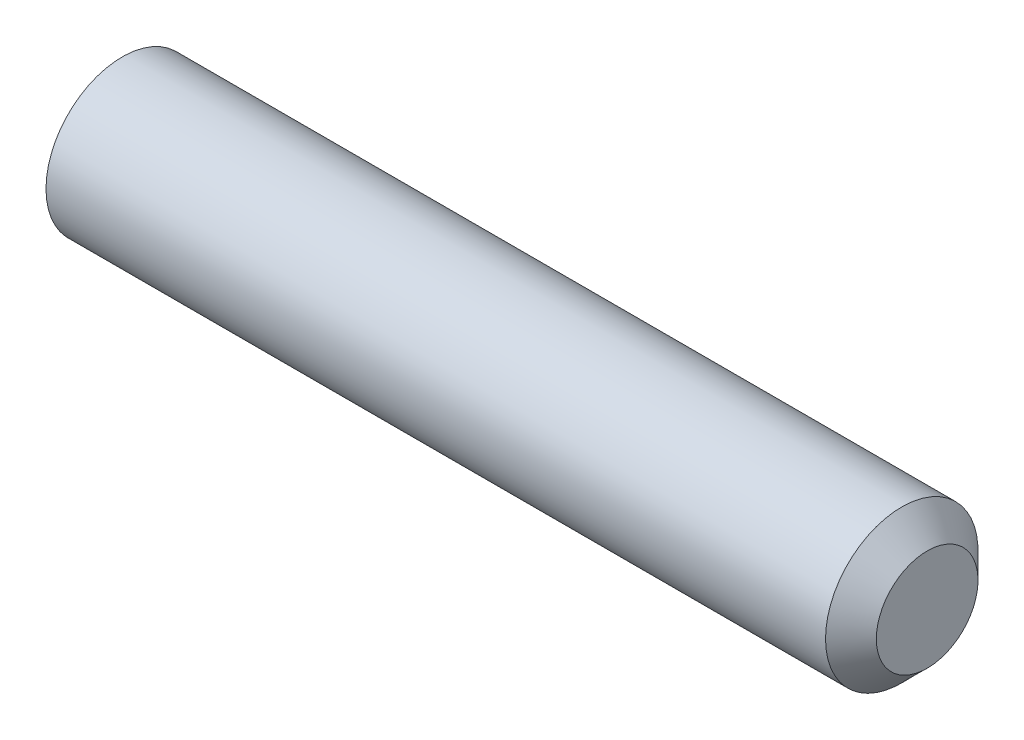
SolidWorks part; units mm, degrees
ref_plane "Plane1" through (0, 0, 0) normal (0, 0, 1) x (1, 0, 0)
ref_plane "Plane2" through (0, 0, 0) normal (0, 1, 0) x (1, 0, 0)
ref_plane "Plane3" through (0, 0, 0) normal (1, 0, 0) x (0, 0, -1)
sketch "BodySke" plane through (0, 0, 0) normal (0, 0, 1) x (1, 0, 0)
  line L0 (0, 0) -> (0, 1.2195)
  line L1 (0, 1.2195) -> (0.1619, 1.5)
  line L2 (0.1619, 1.5) -> (15.5, 1.5)
  line L3 (15.5, 1.5) -> (16, 1)
  line L4 (16, 0) -> (0, 0)
  line L5 (-12.7, 0) -> (88.9, 0) construction
  line L6 (16, 1) -> (16, 0)
  line L7 (16, 1) -> (16, 10.525) construction
  line L8 (0, -1.2195) -> (0.1619, -1.5) construction
  line L9 (0.5, 15.875) -> (0.5, -3.175) construction
  line L10 (15.5, -1.5) -> (16, -1) construction
  dimension "Length" = 16
  dimension "Diameter" = 3
  dimension "Drive_ch_ang" = 60
  dimension "Minor_dia" = 2.439
  dimension "Cup_nose_ang" = 45
  dimension "Cup_dia" = 2
  dimension "Advance" = 0.5
revolve "BaseBody" add sketch "BodySke" angle 360 about L5
sketch "Sketch2" plane through (0, 0, 0) normal (-1, 0, 0) x (0, 0, 1)
  line L0 (0.433, 0.75) -> (-0.433, 0.75)
  line L1 (-0.433, 0.75) -> (-0.866, 0)
  line L2 (0.433, 0.75) -> (0.866, 0)
  line L3 (0.433, -0.75) -> (0.866, 0)
  line L4 (0.433, -0.75) -> (-0.433, -0.75)
  line L5 (-0.433, -0.75) -> (-0.866, 0)
  dimension "Hex_size" = 1.5
  dimension "D2" = 0.75
  dimension "D3" = 0.75
extrude "Hex" cut sketch "Sketch2" against normal blind 2
sketch "ThdSchSke" plane through (0, 0, 0) normal (0, 0, 1) x (1, 0, 0)
  line L0 (0.1619, -1.2195) -> (-0.0345, -1.5)
  line L1 (0.1619, -1.2195) -> (0.3584, -1.5)
  line L2 (0.3584, -1.5) -> (0.3584, -1.875)
  line L3 (-3.175, 0) -> (5.1513, 0) construction
  line L5 (0.3584, -1.875) -> (-0.0345, -1.875)
  line L6 (-0.0345, -1.875) -> (-0.0345, -1.5)
  line L8 (0.1619, 1.5) -> (0.1619, -1.5) construction
  dimension "Thread_minor" = 2.439
  dimension "Diameter" = 3
  dimension "SideAngle" = 55
  dimension "VeeAngle" = 70
  dimension "Overcut" = 3.75
revolve "ThreadSchematic" [suppressed] cut sketch "ThdSchSke" angle 360 about L3
pattern_linear "ThdSchPat" [suppressed]
equation "\"D2@Sketch2\" = \"Hex_size@Sketch2\" / 2"
equation "\"D3@Sketch2\" = \"Hex_size@Sketch2\" / 2"
equation "\"Thread_minor@ThreadCosmetic\" = \"Minor_dia@BodySke\""
equation "\"Thread_minor@ThdSchSke\" = \"Thread_minor@ThreadCosmetic\""
equation "\"Diameter@ThdSchSke\" = \"Diameter@BodySke\""
equation "\"Overcut@ThdSchSke\" = \"Diameter@BodySke\" * 1.25"
equation "\"Num_threads@ThdSchPat\" = int( (\"Length@BodySke\" - ( ( ( \"Diameter@BodySke\" - \"Minor_dia@BodySke\" ) * 0.5 ) / tan( \"Drive_ch_ang@BodySke\" * 0.017453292 ) ) - ( ( ( \"Diameter@BodySke\" - \"Cup_dia@BodySk"
equation "\"Advance@ThdSchPat\" = (\"Length@BodySke\" - ( ( ( \"Diameter@BodySke\" - \"Minor_dia@BodySke\" ) * 0.5 ) / tan( \"Drive_ch_ang@BodySke\" * 0.017453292 ) ) - ( ( ( \"Diameter@BodySke\" - \"Cup_dia@BodySke\" ) * 0."
equation "' \"Num_threads@ThdSchPat\" = \"Num_threads@ThdSchPat\" - sgn( \"Num_threads@ThdSchPat\" - 1) '---chamfered tips only---"
